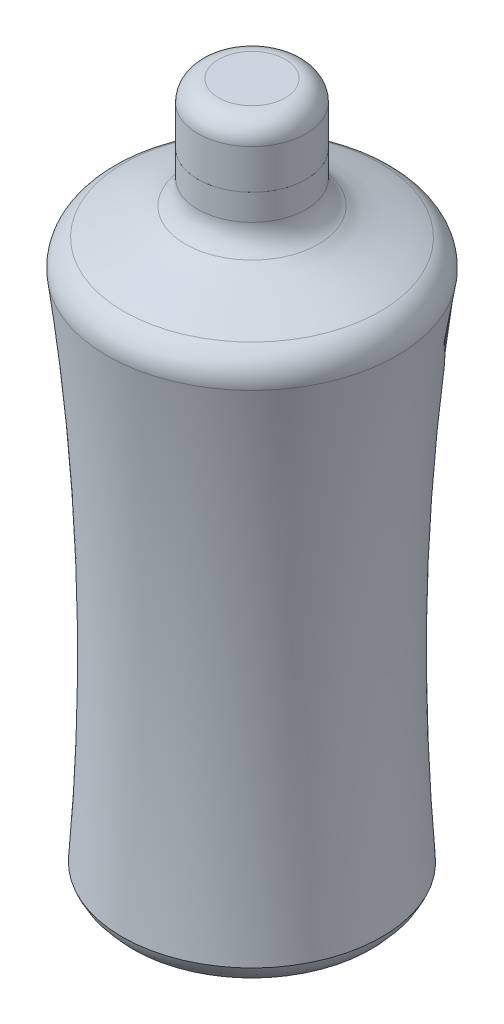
SolidWorks part; units mm, degrees
ref_plane "Front Plane" through (0, 0, 0) normal (0, 0, 1) x (1, 0, 0)
ref_plane "Top Plane" through (0, 0, 0) normal (0, 1, 0) x (1, 0, 0)
ref_plane "Right Plane" through (0, 0, 0) normal (1, 0, 0) x (0, 0, -1)
sketch "Sketch1" plane through (0, 0, 0) normal (0, 0, 1) x (1, 0, 0)
  line L0 (0, 11.3248) -> (40.7197, 11.3248)
  line L1 (0, 373.7621) -> (0, 11.3248)
  line L2 (33.0839, 379.1832) -> (33.0839, 395.1009)
  line L3 (33.0839, 395.1009) -> (0, 395.1009)
  line L4 (0, 395.1009) -> (0, 373.7621)
  arc A0 (67.4221, 3.3104) -> (79.3998, 17.0681) centre (54.5735, 26.5895) ccw
  arc A1 (88.6205, 329.4285) -> (78.4708, 347.8661) centre (70.9909, 331.736) ccw
  arc A2 (33.0839, 379.1832) -> (40.7197, 364.5811) centre (50.8639, 379.1832) ccw
  arc A3 (40.7197, 11.3248) -> (51.5527, 6.2703) centre (40.7197, -2.8114) cw
  arc A4 (51.5527, 6.2703) -> (67.4221, 3.3104) centre (61.2852, 14.4293) ccw
  spline S0 degree 3 poles (79.3998, 17.0681) (71.9627, 121.4884) (75.0377, 225.6533) (88.6205, 329.4285) knots 0 0 0 0 0.960352 0.960352 0.960352 0.960352
  spline S1 degree 3 poles (78.4708, 347.8661) (67.406, 352.997) (47.7667, 358.994) (41.9762, 363.7081) (40.7197, 364.5811) knots 0.136477 0.136477 0.136477 0.136477 0.516914 0.609088 0.609088 0.609088 0.609088
  dimension "D1" = 17.78
  dimension "D2" = 17.78
  dimension "D3" = 12.7
revolve "Revolve1" add sketch "Sketch1" angle 360 about L4
shell "Shell1" thickness 0.508
sketch "Sketch3" plane through (0, 0, 0) normal (0, 0, 1) x (1, 0, 0)
  line L1 (33.0839, 395.1009) -> (-33.0839, 395.1009) construction
  line L2 (0, 395.1009) -> (33.0658, 395.1009)
  line L3 (33.0658, 395.1009) -> (33.0658, 419.2427)
  line L4 (0, 431.9427) -> (0, 395.1009)
  line L5 (20.3658, 431.9427) -> (0, 431.9427)
  arc A0 (33.0658, 419.2427) -> (20.3658, 431.9427) centre (20.3658, 419.2427) ccw
  point P11 (33.0839, 395.1009)
  dimension "D1" = 12.7
revolve "Revolve2" add sketch "Sketch3" angle 360 about L4
